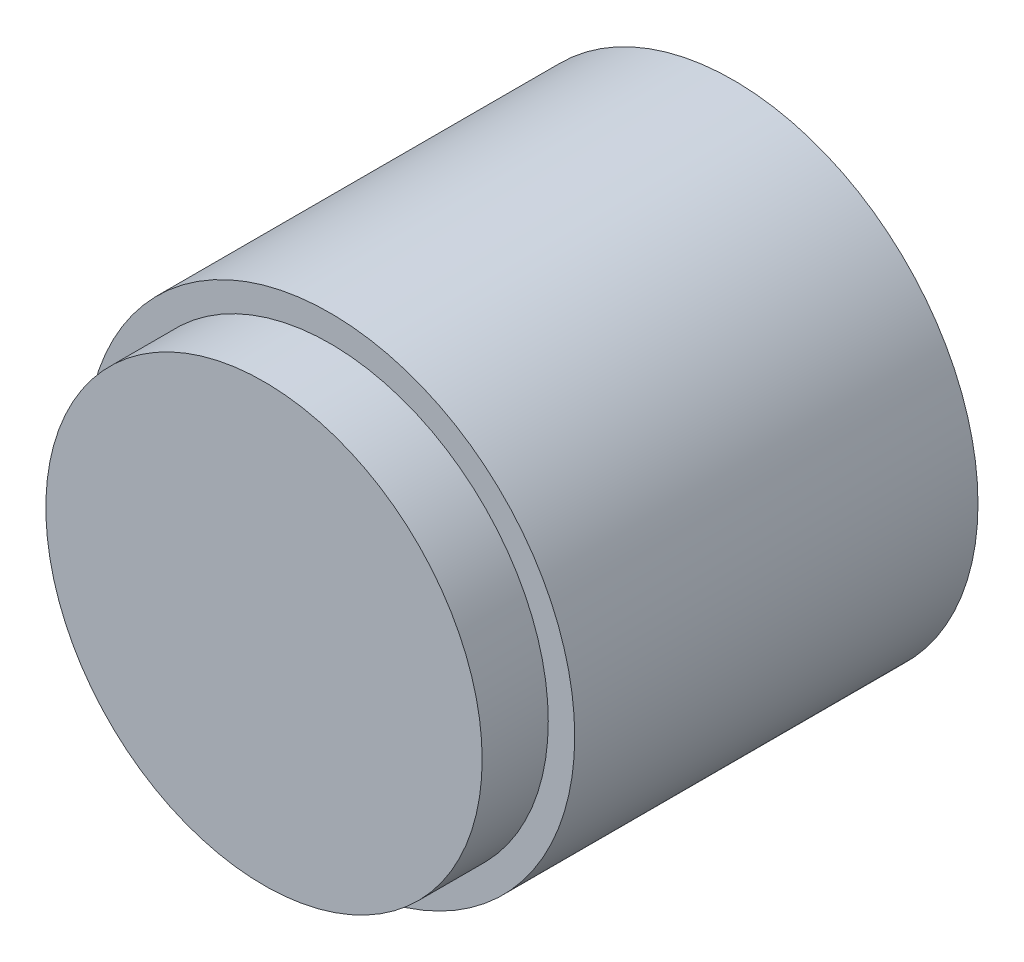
SolidWorks part; units mm, degrees
ref_plane "Ebene vorne" through (0, 0, 0) normal (0, 0, 1) x (1, 0, 0)
ref_plane "Ebene oben" through (0, 0, 0) normal (0, 1, 0) x (1, 0, 0)
ref_plane "Ebene rechts" through (0, 0, 0) normal (1, 0, 0) x (0, 0, -1)
sketch "Skizze1" plane through (0, 0, 0) normal (0, 0, 1) x (1, 0, 0)
  circle A0 centre (0, 0) radius 185
  dimension "D1" = 370
extrude "Aufsatz-Linear austragen1" add sketch "Skizze1" along normal blind 300
sketch "Skizze2" plane through (0, 0, 0) normal (0, 0, -1) x (-1, 0, 0)
  circle A0 centre (0, 0) radius 45
  dimension "D1" = 90
extrude "Schnitt-Linear austragen1" cut sketch "Skizze2" against normal blind 300
sketch "Skizze3" plane through (0, 0, 300) normal (0, 0, 1) x (1, 0, 0)
  circle A0 centre (0, 0) radius 175
  circle A1 centre (0, 0) radius 45 construction
  circle A2 centre (0, 0) radius 45
  dimension "D1" = 350
extrude "Schnitt-Linear austragen2" cut sketch "Skizze3" against normal blind 295 contours A0 M1
sketch "Skizze4" plane through (0, 0, 300) normal (0, 0, 1) x (1, 0, 0)
  circle A0 centre (0, 0) radius 185 construction
  circle A1 centre (0, 0) radius 185
extrude "Aufsatz-Linear austragen2" add sketch "Skizze4" along normal blind 5
sketch "Skizze5" plane through (0, 0, 305) normal (0, 0, 1) x (1, 0, 0)
  point P0 (0, 0)
sketch "Skizze6" plane through (0, 0, 305) normal (0, 0, 1) x (1, 0, 0)
  circle A0 centre (0, 0) radius 165
  dimension "D1" = 330
extrude "Aufsatz-Linear austragen3" add sketch "Skizze6" along normal blind 50
